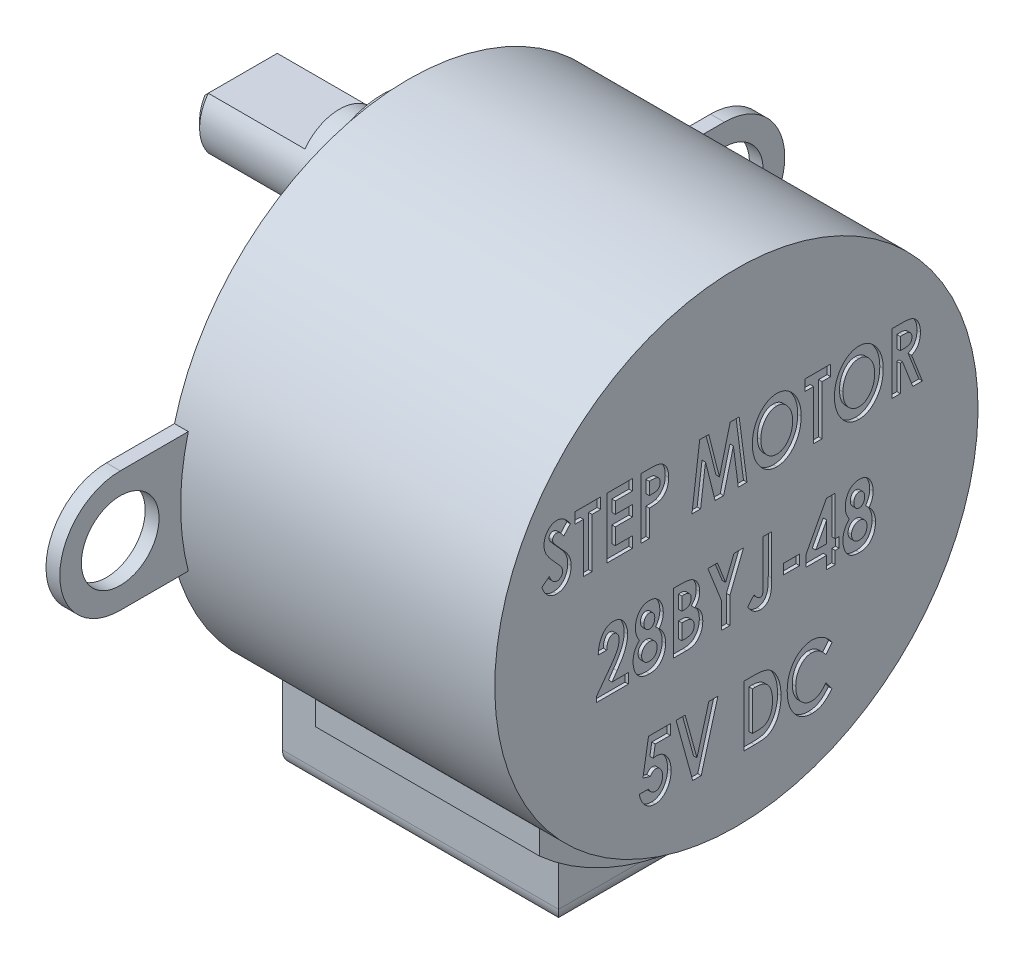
SolidWorks part; units mm, degrees
ref_plane "Plan de face" through (0, 0, 0) normal (0, 0, 1) x (1, 0, 0)
ref_plane "Plan de dessus" through (0, 0, 0) normal (0, 1, 0) x (1, 0, 0)
ref_plane "Plan de droite" through (0, 0, 0) normal (1, 0, 0) x (0, 0, -1)
imported_body "Importée3"
sketch "Esquisse1" plane through (0, -15, 0) normal (0, -1, 0) x (1, 0, 0)
  line L0 (0, 7.3) -> (16, 7.3)
  line L1 (16, 7.3) -> (16, -7.3)
  line L2 (16, -7.3) -> (0, -7.3)
  line L3 (0, -7.3) -> (0, 7.3)
extrude "Boss.-Extru.1" add sketch "Esquisse1" along normal blind 2
fillet "Congé1" radius 1 3 edges at (8, -17, 7.3) (16, -17, 0) (8, -17, -7.3)
imported_body "Importée4"
